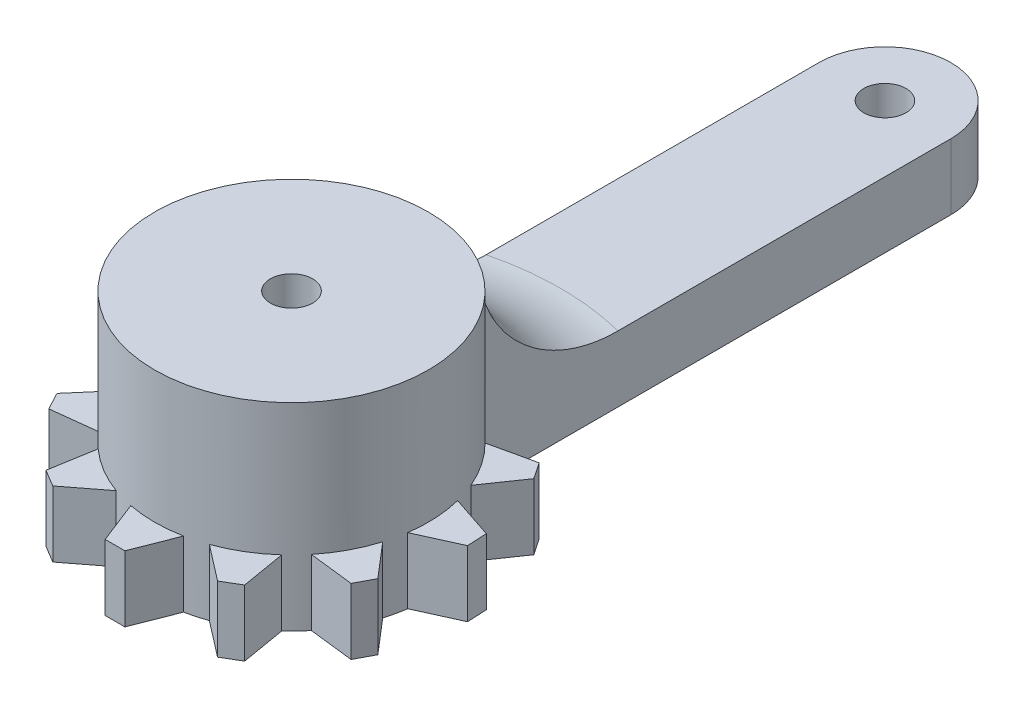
SolidWorks part; units mm, degrees
ref_plane "Front Plane" through (0, 0, 0) normal (0, 0, 1) x (1, 0, 0)
ref_plane "Top Plane" through (0, 0, 0) normal (0, 1, 0) x (1, 0, 0)
ref_plane "Right Plane" through (0, 0, 0) normal (1, 0, 0) x (0, 0, -1)
sketch "Sketch1" plane through (0, 0, 0) normal (0, 1, 0) x (1, 0, 0)
  line L0 (0, 0) -> (0, 45) construction
  line L1 (-5, 0) -> (-5, 45)
  line L2 (5, 0) -> (5, 45)
  circle A0 centre (0, 0) radius 10.38
  arc A1 (-5, 0) -> (5, 0) centre (0, 0) ccw
  arc A2 (5, 45) -> (-5, 45) centre (0, 45) ccw
  circle A3 centre (0, 45) radius 1.6
  circle A4 centre (0, 0) radius 1.6
  point P3 (0, 22.5)
  dimension "D1" = 20.76
  dimension "D4" = 3.2
  dimension "D5" = 3.2
  dimension "D2" = 10
  dimension "D3" = 45
extrude "Boss-Extrude1" add sketch "Sketch1" along normal blind 5
sketch "Sketch2" plane through (0, 5, 0) normal (0, 1, 0) x (1, 0, 0)
  line L0 (0, -10.38) -> (0, -13.38) construction
  line L1 (-0.75, -13.38) -> (0.75, -13.38)
  line L2 (0.75, -13.38) -> (2, -10.1855)
  line L3 (-0.75, -13.38) -> (-2, -10.1855)
  arc A0 (-5, 9.0964) -> (5, 9.0964) centre (0, 0) ccw construction
  arc A1 (-2, -10.1855) -> (2, -10.1855) centre (0, 0) ccw
  point P14 (0, -13.38)
  dimension "D1" = 3
  dimension "D2" = 1.5
  dimension "D3" = 4
extrude "Boss-Extrude2" add sketch "Sketch2" against normal up to surface (5 mm away)
pattern_circular "CirPattern1" count 5 every 31 about axis through (0, 0, 0) along (0, 1, 0) of "Boss-Extrude2"
sketch "Sketch3" plane through (0, 5, 0) normal (0, 1, 0) x (1, 0, 0)
  circle A0 centre (0, 0) radius 5.975
  circle A1 centre (0, 0) radius 1.6
  circle A2 centre (0, 0) radius 3.25
  arc A3 (7.3258, 7.3537) -> (5, 9.0964) centre (0, 0) ccw construction
  dimension "D1" = 11.95
  dimension "D2" = 6.5
  dimension "D3" = 3.2
extrude "Boss-Extrude3" [suppressed] add sketch "Sketch3" along normal blind 6.6 contours A0 A2
chamfer "Chamfer1" [suppressed] distance 1 angle 45
chamfer "Chamfer2" [suppressed] distance 0.5 angle 45
sketch "Sketch4" plane through (0, 5, 0) normal (0, 1, 0) x (1, 0, 0)
  circle A0 centre (0, 0) radius 10.38
  circle A1 centre (0, 0) radius 1.6
  circle A2 centre (0, 0) radius 1.6 construction
  arc A3 (-10.2762, -1.4642) -> (-9.9322, -3.0159) centre (0, 0) ccw construction
extrude "Boss-Extrude4" add sketch "Sketch4" along normal blind 10
fillet "Fillet1" radius 10 1 edges at (0, 5, -10.38)
